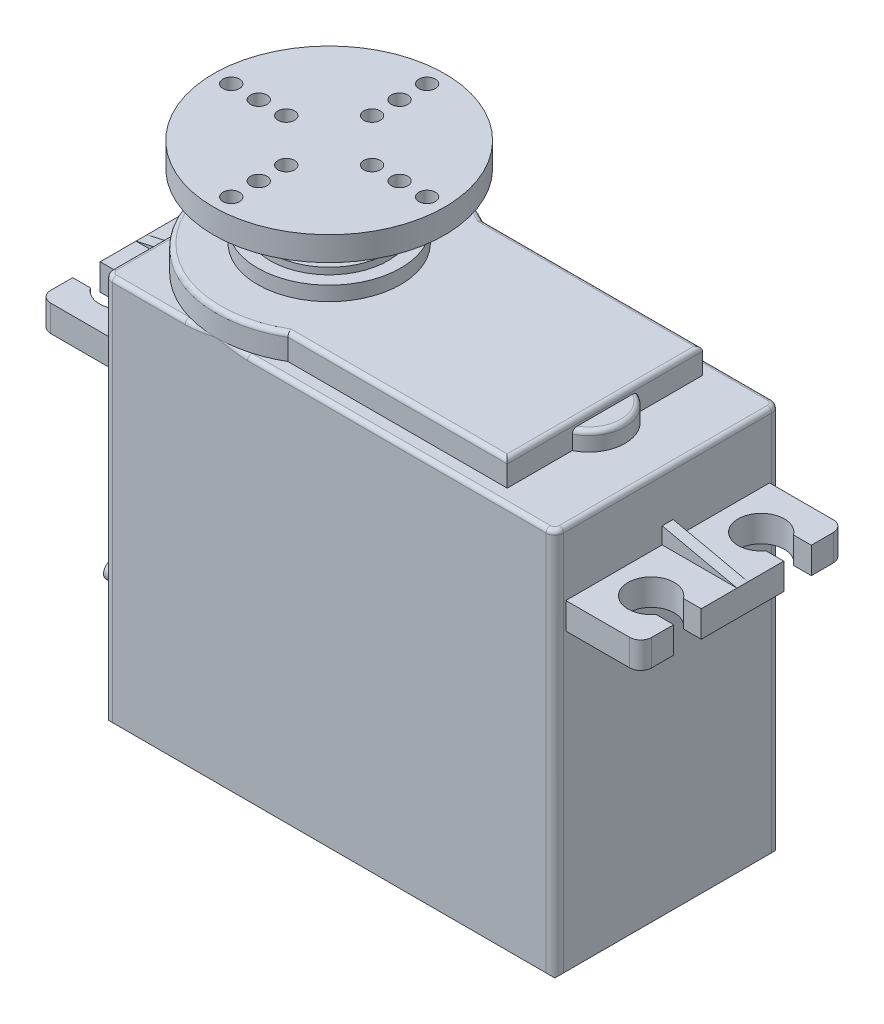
SolidWorks part; units mm, degrees
ref_plane "Front Plane" through (0, 0, 0) normal (0, 0, 1) x (1, 0, 0)
ref_plane "Top Plane" through (0, 0, 0) normal (0, 1, 0) x (1, 0, 0)
ref_plane "Right Plane" through (0, 0, 0) normal (1, 0, 0) x (0, 0, -1)
sketch "Sketch1" plane through (0, 0, 0) normal (0, 1, 0) x (1, 0, 0)
  line L1 (-20.5, -10.25) -> (20.5, -10.25)
  line L2 (-20.5, -10.25) -> (-20.5, 10.25)
  line L3 (-20.5, 10.25) -> (20.5, 10.25)
  line L4 (20.5, -10.25) -> (20.5, 10.25)
  line L5 (-20.5, -10.25) -> (20.5, 10.25) construction
  line L6 (-20.5, 10.25) -> (20.5, -10.25) construction
  point P0 (0, 0)
  dimension "D1" = 41
  dimension "D2" = 20.5
extrude "Boss-Extrude1" add sketch "Sketch1" along normal blind 37
sketch "Sketch2" plane through (0, 37, 0) normal (0, 1, 0) x (1, 0, 0)
  line L0 (-20.5, 10.25) -> (-20.5, -10.25) construction
  line L1 (20.5, -10.25) -> (20.5, 10.25) construction
  line L2 (-5.122, -8.875) -> (14.8, -8.875)
  line L4 (-5.122, 8.875) -> (14.8, 8.875)
  line L5 (14.8, -8.875) -> (14.8, -2.9672)
  line L9 (14.8, 2.9672) -> (14.8, 8.875)
  arc A0 (-5.122, 8.875) -> (-5.122, -8.875) centre (-10.25, 0) ccw
  arc A1 (14.8, -2.9672) -> (14.8, 2.9672) centre (13.3208, 0) ccw
  point P5 (4.4919, 0)
  dimension "D1" = 10.25
  dimension "D2" = 17.75
  dimension "D3" = 5.7
extrude "Boss-Extrude2" add sketch "Sketch2" along normal blind 2.3
sketch "Sketch3" plane through (0, 39.3, 0) normal (0, 1, 0) x (1, 0, 0)
  circle A0 centre (-10.25, 0) radius 6.5
  dimension "D1" = 13
extrude "Boss-Extrude3" add sketch "Sketch3" along normal blind 1.3
sketch "Sketch4" plane through (0, 40.6, 0) normal (0, 1, 0) x (1, 0, 0)
  circle A0 centre (-10.25, 0) radius 5.35
  dimension "D1" = 10.7
extrude "Boss-Extrude4" add sketch "Sketch4" along normal blind 0.6
sketch "Sketch5" plane through (0, 39.3, 0) normal (0, 1, 0) x (1, 0, 0)
  line L0 (14.8, 2.9672) -> (14.8, -2.9672)
  arc A0 (14.8, -2.9672) -> (14.8, 2.9672) centre (13.3208, 0) ccw construction
  arc A1 (14.8, -2.9672) -> (14.8, 2.9672) centre (13.3208, 0) ccw
extrude "Cut-Extrude1" cut sketch "Sketch5" against normal blind 0.6
sketch "Sketch6" plane through (0, 41.2, 0) normal (0, 1, 0) x (1, 0, 0)
  circle A0 centre (-10.25, 0) radius 3
  dimension "D1" = 6
extrude "Boss-Extrude5" add sketch "Sketch6" along normal blind 4
chamfer "Chamfer1" distance 2 angle 45 4 edges at (-20.5, 0, 0) (0, 0, -10.25) (20.5, 0, 0) (0, 0, 10.25)
fillet "Fillet2" radius 0.8 4 edges at (-20.5, 19.5, -10.25) (-20.5, 19.5, 10.25) (20.5, 19.5, -10.25) (20.5, 19.5, 10.25)
sketch "Sketch7" plane through (-20.5, 0, 0) normal (-1, 0, 0) x (0, 0, 1)
  line L1 (-9.25, 31.2) -> (9.25, 31.2)
  line L2 (-9.25, 31.2) -> (-9.25, 28.8)
  line L3 (-9.25, 28.8) -> (9.25, 28.8)
  line L4 (9.25, 31.2) -> (9.25, 28.8)
  line L6 (-9.45, 37) -> (0, 37) construction
  line L9 (-10.25, 37) -> (-10.25, 2) construction
  dimension "D1" = 5.8
  dimension "D2" = 2.4
  dimension "D3" = 18.5
  dimension "D4" = 1
extrude "Boss-Extrude6" add sketch "Sketch7" along normal blind 6.8
sketch "Sketch9" plane through (0, 31.2, 0) normal (0, 1, 0) x (1, 0, 0)
  line L0 (-27.3, -9.25) -> (-27.3, 9.25) construction
  line L3 (-25.6875, 6.25) -> (-27.3, 6.25)
  line L4 (-21.6, 3.75) -> (-22.3125, 3.75)
  line L5 (-21.6, 3.75) -> (-21.6, 6.25)
  line L6 (-21.6, 6.25) -> (-22.3125, 6.25)
  line L7 (-27.3, 3.75) -> (-27.3, 6.25)
  line L8 (-21.6, 3.75) -> (-24, 5) construction
  line L9 (-21.6, 6.25) -> (-24, 5) construction
  line L10 (-21.6, -6.25) -> (-27.3, -6.25)
  line L11 (-21.6, -6.25) -> (-21.6, -3.75)
  line L12 (-21.6, -3.75) -> (-27.3, -3.75)
  line L13 (-27.3, -6.25) -> (-27.3, -3.75)
  line L14 (-21.6, -6.25) -> (-24, -5) construction
  line L15 (-21.6, -3.75) -> (-24, -5) construction
  line L18 (-25.6875, 3.75) -> (-27.3, 3.75)
  arc A0 (-25.6875, 3.75) -> (-25.6875, 6.25) centre (-24, 5) ccw
  arc A1 (-25.6875, -6.25) -> (-25.6875, -3.75) centre (-24, -5) ccw
  dimension "D1" = 4.2
  dimension "D2" = 4.2
  dimension "D3" = 3.3
  dimension "D4" = 10
  dimension "D5" = 5
  dimension "D6" = 2.5
  dimension "D7" = 2.5
  dimension "D8" = 3.3
extrude "Cut-Extrude2" cut sketch "Sketch9" against normal blind 6.8 contours A0 L3 L18 M4 | L12 A1 | L10 A1 | L10 A1 L12 M4
fillet "Fillet1" radius 1 2 edges at (-27.3, 30, 9.25) (-27.3, 30, -9.25)
sketch "Sketch10" plane through (0, 31.2, 0) normal (0, 1, 0) x (1, 0, 0)
  line L0 (-20.5, -9.25) -> (-20.5, 9.25) construction
  line L1 (-27.3, -0.5) -> (-20.5, -0.5)
  line L2 (-27.3, -0.5) -> (-27.3, 0.5)
  line L3 (-27.3, 0.5) -> (-20.5, 0.5)
  line L4 (-20.5, -0.5) -> (-20.5, 0.5)
  line L5 (-27.3, -0.5) -> (-20.5, 0.5) construction
  line L6 (-27.3, 0.5) -> (-20.5, -0.5) construction
  line L7 (-27.3, -3.75) -> (-27.3, 3.75) construction
  point P0 (-23.9, 0)
  dimension "D1" = 1
extrude "Boss-Extrude7" add sketch "Sketch10" along normal blind 1.5
sketch "Sketch11" plane through (0, 0, 0.5) normal (0, 0, 1) x (1, 0, 0)
  line L0 (-27.3, 31.2) -> (-20.5, 32.7)
  line L1 (-20.5, 32.7) -> (-27.3, 32.7)
  line L2 (-27.3, 32.7) -> (-27.3, 31.2)
extrude "Cut-Extrude3" cut sketch "Sketch11" against normal blind 1.5
ref_plane "Plane1" through (0, 0, 0) normal (-1, 0, 0) x (0, 0, 1)
mirror "Mirror2" about plane through (0, 0, 0) normal (-1, 0, 0) of "Cut-Extrude3", "Boss-Extrude7", "Fillet1", "Cut-Extrude2", "Boss-Extrude6"
sketch "Sketch12" plane through (0, 45.2, 0) normal (0, 1, 0) x (1, 0, 0)
  circle A0 centre (-10.25, 0) radius 1.25
  dimension "D1" = 2.5
extrude "Cut-Extrude4" cut sketch "Sketch12" against normal blind 4
fillet "Fillet5" radius 0.4 5 edges at (16.6363, 38.7, 0) (14.8, 39.3, 0) (4.839, 39.3, -8.875) (-20.5, 39.3, 0) (4.839, 39.3, 8.875)
fillet "Fillet7" radius 0.4 11 edges at (20.2657, 37, 10.0157) (4.725, 37, 10.25) (-14.975, 37, 10.25) (-20.2657, 37, 10.0157) (-20.5, 37, 4.725) (-20.5, 37, -4.725) (-20.2657, 37, -10.0157) (-14.975, 37, -10.25) (4.725, 37, -10.25) (20.2657, 37, -10.0157) (20.5, 37, 0)
sketch "Sketch13" plane through (-20.5, 0, 0) normal (-1, 0, 0) x (0, 0, 1)
  line L0 (8.25, 0) -> (-8.25, 0) construction
  line L1 (-3.5, 3.2) -> (3.5, 3.2)
  line L2 (-3.5, 3.2) -> (-3.5, 7.4)
  line L3 (-3.5, 7.4) -> (3.5, 7.4)
  line L4 (3.5, 3.2) -> (3.5, 7.4)
  line L5 (-3.5, 3.2) -> (3.5, 7.4) construction
  line L6 (-3.5, 7.4) -> (3.5, 3.2) construction
  point P0 (0, 5.3)
  dimension "D1" = 7
  dimension "D2" = 4.2
  dimension "D3" = 3.2
extrude "Boss-Extrude8" add sketch "Sketch13" along normal blind 1
sketch "Sketch14" plane through (-21.5, 0, 0) normal (-1, 0, 0) x (0, 0, 1)
  line L9 (3.15, 3.55) -> (3.15, 7.05)
  line L10 (3.15, 7.05) -> (-3.15, 7.05)
  line L11 (-3.15, 7.05) -> (-3.15, 3.55)
  line L12 (-3.15, 3.55) -> (3.15, 3.55)
  line L13 (3.15, 3.55) -> (3.15, 7.05)
  line L14 (3.15, 7.05) -> (-3.15, 7.05)
  line L15 (-3.15, 7.05) -> (-3.15, 3.55)
  line L16 (-3.15, 3.55) -> (3.15, 3.55)
  dimension "D1" = 0.35
extrude "Boss-Extrude9" add sketch "Sketch14" along normal blind 4 draft 5 contours L14 L15 L16 L13
sketch "Sketch15" plane through (-25.5, 0, 0) normal (-1, 0, 0) x (0, 0, 1)
  line L0 (-2.8, 3.9) -> (2.8, 3.9) construction
  circle A0 centre (-1.5, 5.3) radius 0.75
  circle A1 centre (0, 5.3) radius 0.75
  circle A2 centre (1.5, 5.3) radius 0.75
  dimension "D1" = 1.5
  dimension "D2" = 1.5
  dimension "D3" = 1.5
  dimension "D4" = 1.4
extrude "Boss-Extrude12" add sketch "Sketch15" along normal blind 3 separate body contours A0 | A1 | A2
sketch "Sketch16" plane through (0, 45.2, 0) normal (0, 1, 0) x (1, 0, 0)
  circle A0 centre (-10.25, 0) radius 10.5
  dimension "D1" = 21
extrude "Boss-Extrude13" add sketch "Sketch16" along normal blind 2.2
sketch "Sketch17" plane through (0, 47.4, 0) normal (0, 1, 0) x (1, 0, 0)
  circle A0 centre (-19.1465, 0) radius 0.75
  circle A1 centre (-16.6465, 0) radius 0.75
  circle A2 centre (-14.1465, 0) radius 0.75
  circle A3 centre (-10.25, 3.8965) radius 0.75
  circle A4 centre (-10.25, 6.3965) radius 0.75
  circle A5 centre (-10.25, 8.8965) radius 0.75
  circle A6 centre (-6.3535, 0) radius 0.75
  circle A7 centre (-3.8535, 0) radius 0.75
  circle A8 centre (-1.3535, 0) radius 0.75
  circle A9 centre (-10.25, -3.8965) radius 0.75
  circle A10 centre (-10.25, -6.3965) radius 0.75
  circle A11 centre (-10.25, -8.8965) radius 0.75
  point P3 (-10.25, 0)
  point P29 (-10.25, 0)
  dimension "D1" = 3
  dimension "D2" = 1.5
  dimension "D3" = 4
extrude "Cut-Extrude5" cut sketch "Sketch17" against normal up to next
